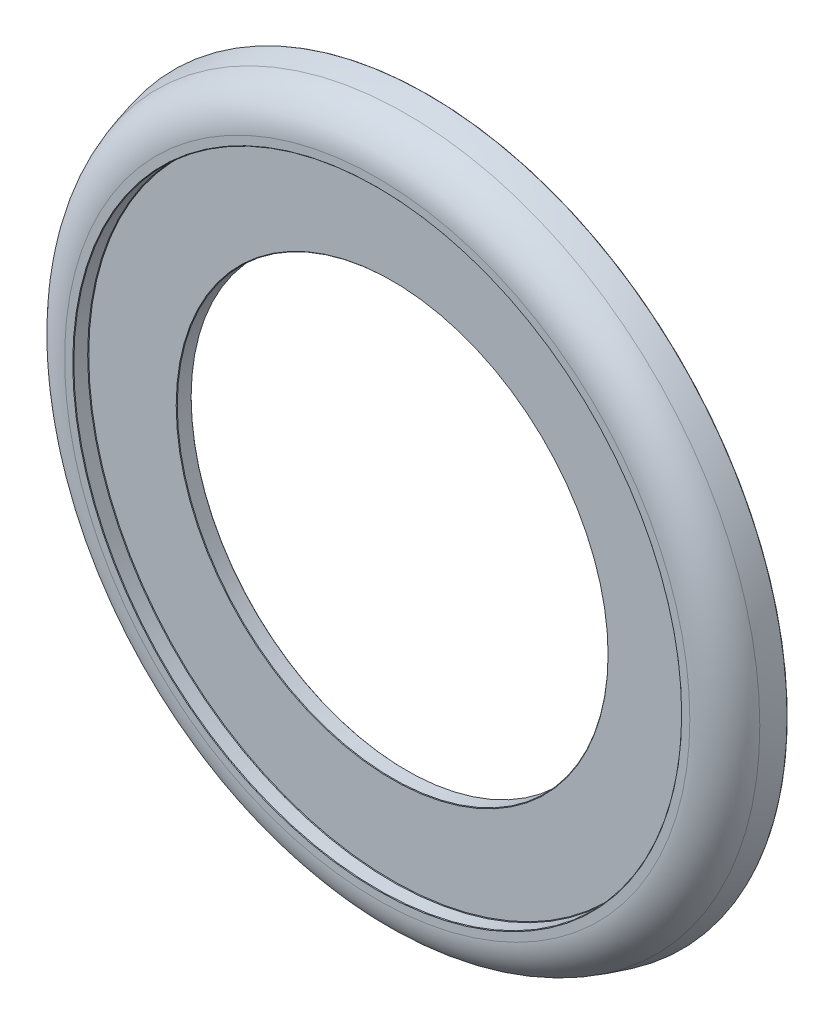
SolidWorks part; units mm, degrees
ref_plane "Спереди" through (0, 0, 0) normal (0, 0, 1) x (1, 0, 0)
ref_plane "Сверху" through (0, 0, 0) normal (0, 1, 0) x (1, 0, 0)
ref_plane "Справа" through (0, 0, 0) normal (1, 0, 0) x (0, 0, -1)
sketch "Эскиз1" plane through (0, 0, 0) normal (1, 0, 0) x (0, 0, -1)
  line L0 (0, 0) -> (24, 0) construction
  line L1 (0, 142.5) -> (7, 142.5)
  line L2 (7, 142.5) -> (7, 101)
  line L3 (7, 101) -> (14, 101)
  line L4 (14, 101) -> (14, 156)
  line L5 (14, 156) -> (24, 156)
  line L6 (24, 156) -> (24, 168.4487)
  line L7 (0, 171.75) -> (110.8486, 171.75) construction
  line L8 (0, 142.5) -> (0, 0) construction
  line L9 (0, 142.5) -> (0, 146.5765)
  arc A0 (24, 168.4487) -> (13.79, 165.588) centre (52.5, 47.08) ccw
  arc A2 (13.79, 165.588) -> (0, 146.5765) centre (20, 146.5765) ccw
  dimension "D7" = 249.34
  dimension "D10" = 40
  dimension "D1" = 10
  dimension "D2" = 285
  dimension "D3" = 312
  dimension "D4" = 7
  dimension "D5" = 202
  dimension "D6" = 24
  dimension "D8" = 28.5
  dimension "D9" = 171.75
revolve "Повернуть1" add sketch "Эскиз1" angle 360 about L0
sketch "Эскиз2" plane through (0, 0, -24) normal (0, 0, -1) x (-1, 0, 0)
  line L1 (0, 30) -> (179.312, 30)
  line L2 (0, 30) -> (0, -30)
  line L3 (0, -30) -> (179.312, -30)
  line L4 (179.312, 30) -> (179.312, -30)
  dimension "D1" = 60
  dimension "D2" = 30
extrude "Вырез-Вытянуть1" cut sketch "Эскиз2" against normal blind 3
sketch "Эскиз3" plane through (0, 0, -24) normal (0, 0, -1) x (-1, 0, 0)
  point P8 (-160.73, 0)
  dimension "D1" = 160.73
hole_wizard "Диаметр отверстия Ø4.0 (4)1" positions "Трехмерный эскиз2" profile "Эскиз5" hole size "Ø4.0" standard "ГОСТ"
sketch3d "Трехмерный эскиз2"
  point P0 (160.73, 0, -24)
sketch "Эскиз5" plane through (160.73, 0, -24) normal (1, 0, 0) x (0, 1, 0)
  line L0 (0, 0) -> (0, 12.2017)
  line L1 (0, 12.2017) -> (2, 11)
  line L2 (2, 11) -> (2, 0)
  line L5 (2, 0) -> (0, 0)
  line L10 (0, 12.2017) -> (-2, 11) construction
  line L11 (0, -6.35) -> (0, 107.95) construction
  dimension "Диаметр отверстия" = 4
  dimension "Глубина отверстия" = 11
  dimension "Угол заточки сверла" = 118
chamfer "Фаска1" distance 0.25 angle 45 18 edges at (142.5, 0, -7) (101, 0, -7) (101, 0, -14) (156, 0, -14) (-167.7049, 0, -21) (-153.0882, 30, -22.5) (-159.044, -30, -21) (-159.044, 30, -21) (-156, 0, -21) (-153.0882, -30, -22.5) (168.4487, 0, -24) (-159.422, 30, -24) (-159.422, -30, -24) (156, 0, -24) (158.73, 0, -24) (142.5, 0, 0)
sketch "Эскиз6" plane through (0, 0, -21) normal (0, 0, -1) x (-1, 0, 0)
  line L0 (167.6367, 31.0938) -> (167.6367, -32.7309) construction
  circle A0 centre (159.1367, 20) radius 0.8625
  circle A1 centre (159.1367, 0) radius 0.8625
  circle A2 centre (159.1367, -20) radius 0.8625
  arc A3 (164.9703, -29.7801) -> (164.9703, 29.7801) centre (0, 0) ccw construction
  dimension "D3" = 1.725
  dimension "D1" = 20
  dimension "D2" = 20
  dimension "D4" = 8.5
extrude "Вырез-Вытянуть2" cut sketch "Эскиз6" against normal blind 12
chamfer "Фаска2" distance 0.2 angle 45 3 edges at (-159.9992, -20, -21) (-159.9992, 0, -21) (-159.9992, 20, -21)
